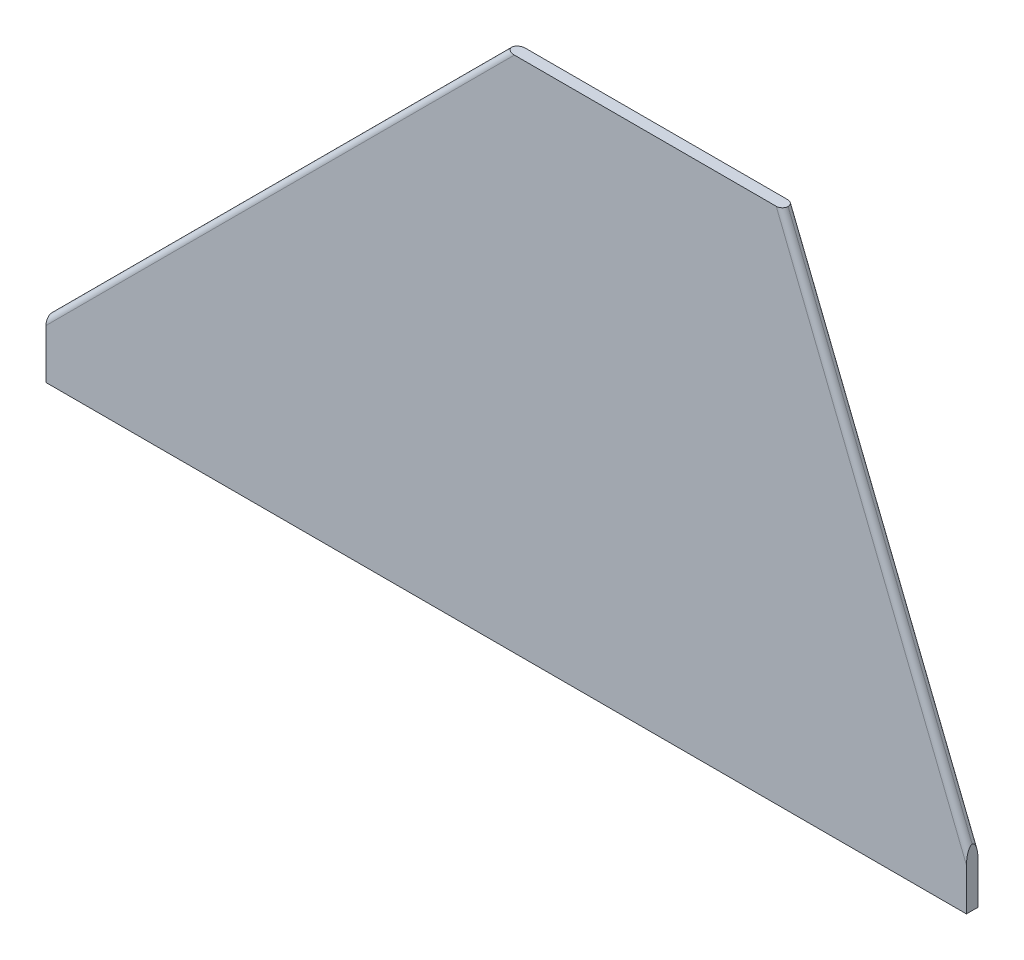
SolidWorks part; units mm, degrees
ref_plane "Front Plane" through (0, 0, 0) normal (0, 0, 1) x (1, 0, 0)
ref_plane "Top Plane" through (0, 0, 0) normal (0, 1, 0) x (1, 0, 0)
ref_plane "Right Plane" through (0, 0, 0) normal (1, 0, 0) x (0, 0, -1)
sketch "Sketch1" plane through (0, 0, 0) normal (0, 0, 1) x (1, 0, 0)
  line L1 (70.0135, 0) -> (44.6135, 63.5)
  line L2 (44.6135, 63.5) -> (6.5135, 63.5)
  line L3 (6.5135, 63.5) -> (-56.9865, 0)
  line L6 (-56.9865, 0) -> (-56.9865, -9.525)
  line L7 (-56.9865, -9.525) -> (70.0135, -9.525)
  line L8 (70.0135, 0) -> (70.0135, -9.525)
  dimension "D1" = 9.525
  dimension "D2" = 127
  dimension "D3" = 25.4
  dimension "D4" = 38.1
extrude "Extrude1" add sketch "Sketch1" along normal blind 1.5875
fillet "Fillet1" radius 0.7937 4 edges at (57.3135, 31.75, 1.5875) (57.3135, 31.75, 0) (-25.2365, 31.75, 0) (-25.2365, 31.75, 1.5875)
sketch "Sketch2" plane through (70.0135, 0, 0) normal (1, 0, 0) x (0, 0, -1)
  line L0 (-0.7937, -0.9996) -> (-0.7937, -90.4799) construction
  line L1 (-1.5875, -9.525) -> (-1.5875, -2.1372) construction
  circle A1 centre (-0.7937, -28.5597) radius 20.6375
  dimension "D1" = 41.275
  dimension "D2" = 0.7937
extrude "Cut-Extrude1" cut sketch "Sketch2" against normal through all
